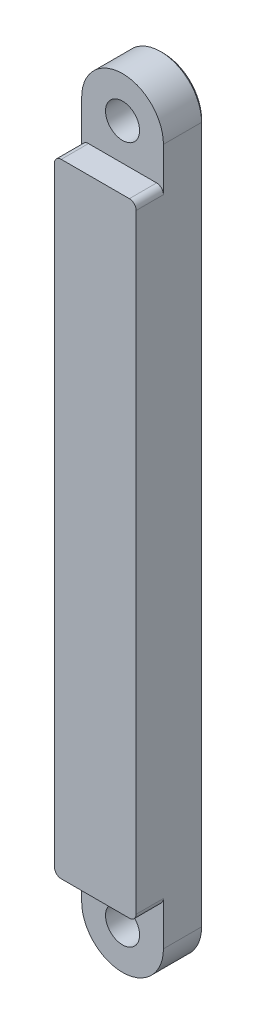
SolidWorks part; units mm, degrees
ref_plane "Płaszczyzna przednia" through (0, 0, 0) normal (0, 0, 1) x (1, 0, 0)
ref_plane "Płaszczyzna górna" through (0, 0, 0) normal (0, 1, 0) x (1, 0, 0)
ref_plane "Płaszczyzna prawa" through (0, 0, 0) normal (1, 0, 0) x (0, 0, -1)
sketch "Szkic1" plane through (0, 0, 0) normal (0, 0, 1) x (1, 0, 0)
  line L0 (-51.5557, 47.6771) -> (-51.5557, -3.4597) construction
  line L1 (-48.5557, 47.6771) -> (-48.5557, -3.4597)
  line L2 (-54.5557, 47.6771) -> (-54.5557, -3.4597)
  circle A0 centre (-51.5557, 47.6771) radius 1.25
  circle A1 centre (-51.5557, -3.4597) radius 1.25
  arc A2 (-48.5557, 47.6771) -> (-54.5557, 47.6771) centre (-51.5557, 47.6771) ccw
  arc A3 (-54.5557, -3.4597) -> (-48.5557, -3.4597) centre (-51.5557, -3.4597) ccw
  point P1 (-51.5557, 22.1087)
  dimension "D1" = 51.1368
  dimension "D2" = 6
extrude "Dodanie-wyciągnięcie1" add sketch "Szkic1" along normal blind 3
sketch "Szkic2" plane through (0, 0, 3) normal (0, 0, 1) x (1, 0, 0)
  line L2 (-54.5557, -0.7597) -> (-48.5557, -0.7597)
  line L3 (-54.5557, 44.9771) -> (-48.5557, 44.9771)
  line L4 (-48.5557, -3.4597) -> (-48.5557, 47.6771) construction
  line L5 (-54.5557, 47.6771) -> (-54.5557, -3.4597) construction
  line L6 (-48.5557, -0.7597) -> (-48.5557, 44.9771)
  line L7 (-54.5557, 44.9771) -> (-54.5557, -0.7597)
  arc A1 (-54.5557, -3.4597) -> (-48.5557, -3.4597) centre (-51.5557, -3.4597) ccw construction
  arc A2 (-48.5557, 47.6771) -> (-54.5557, 47.6771) centre (-51.5557, 47.6771) ccw construction
  point P10 (-51.5557, -6.4597)
  point P11 (-51.5557, 50.6771)
  dimension "D1" = 5.7
  dimension "D2" = 5.7
extrude "Dodanie-wyciągnięcie2" add sketch "Szkic2" along normal blind 2
fillet "Zaokrąglenie1" radius 0.5 4 edges at (-48.5557, -0.7597, 4) (-54.5557, -0.7597, 4) (-48.5557, 44.9771, 4) (-54.5557, 44.9771, 4)
chamfer "Sfazowanie1" distance 0.2 angle 45 6 edges at (-50.3057, -3.4597, 0) (-50.3057, 47.6771, 0) (-54.5557, 22.1087, 0) (-51.5557, -6.4597, 0) (-48.5557, 22.1087, 0) (-51.5557, 50.6771, 0)
